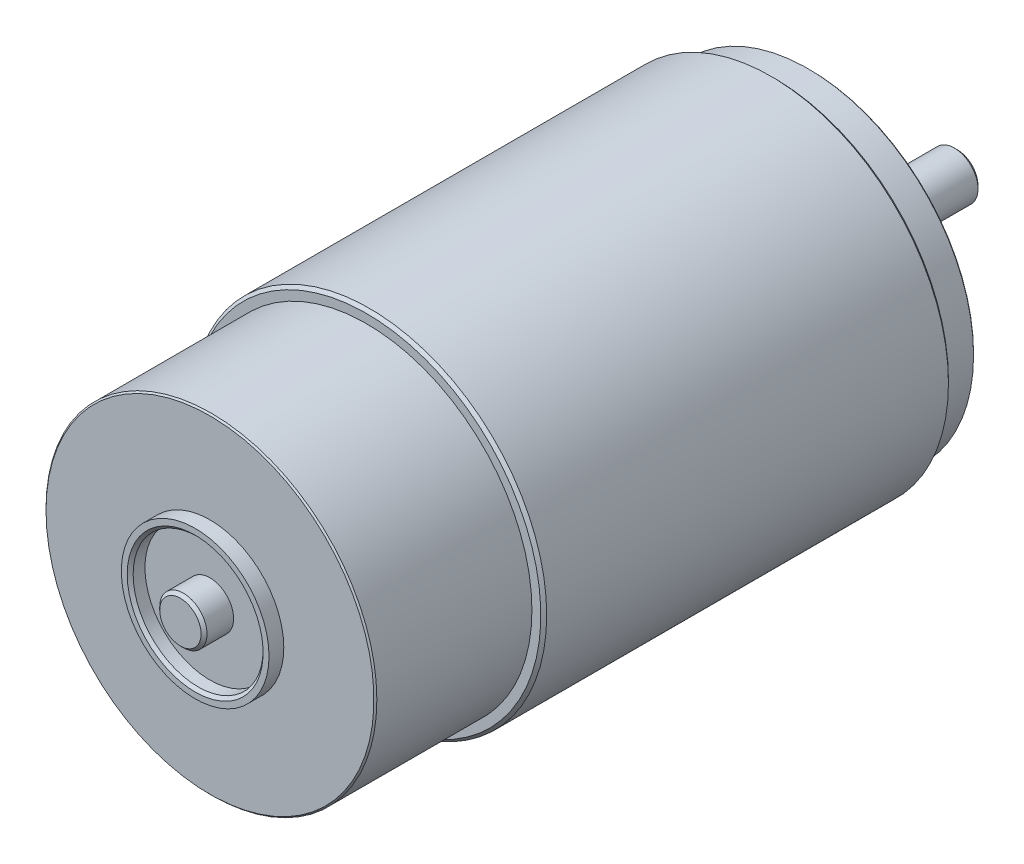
SolidWorks part; units mm, degrees
ref_plane "Front Plane" through (0, 0, 0) normal (0, 0, 1) x (1, 0, 0)
ref_plane "Top Plane" through (0, 0, 0) normal (0, 1, 0) x (1, 0, 0)
ref_plane "Right Plane" through (0, 0, 0) normal (1, 0, 0) x (0, 0, -1)
sketch "Sketch1" plane through (0, 0, 0) normal (0, 1, 0) x (1, 0, 0)
  line L0 (-8.5379, -81.0483) -> (-8.5379, 50.4517) construction
  line L1 (-8.5379, -81.0483) -> (-12.5379, -81.0483)
  line L2 (-12.5379, -81.0483) -> (-12.5379, -76.0483)
  line L3 (-12.5379, -76.0483) -> (-19.5379, -76.0483)
  line L4 (-19.5379, -76.0483) -> (-19.5379, -78.5483)
  line L5 (-19.5379, -78.5483) -> (-21.0379, -78.5483)
  line L6 (-21.0379, -78.5483) -> (-21.0379, -76.0483)
  line L7 (-21.0379, -76.0483) -> (-36.5379, -76.0483)
  line L8 (-36.5379, -76.0483) -> (-36.5379, -49.5483)
  line L9 (-36.5379, -49.5483) -> (-38.5379, -49.5483)
  line L10 (-38.5379, -49.5483) -> (-38.5379, 19.4517)
  line L11 (-38.5379, 19.4517) -> (-36.5379, 19.4517)
  line L12 (-36.5379, 19.4517) -> (-36.5379, 25.4517)
  line L13 (-36.5379, 25.4517) -> (-21.0379, 25.4517)
  line L14 (-21.0379, 25.4517) -> (-21.0379, 27.9517)
  line L15 (-21.0379, 27.9517) -> (-19.5379, 27.9517)
  line L16 (-19.5379, 27.9517) -> (-19.5379, 25.4517)
  line L17 (-19.5379, 25.4517) -> (-12.5379, 25.4517)
  line L18 (-12.5379, 25.4517) -> (-12.5379, 50.4517)
  line L19 (-12.5379, 50.4517) -> (-8.5379, 50.4517)
  line L20 (-8.5379, -81.0483) -> (-8.5379, 50.4517)
  dimension "D1" = 8
  dimension "D2" = 22
  dimension "D3" = 25
  dimension "D4" = 56
  dimension "D5" = 60
  dimension "D6" = 56
  dimension "D7" = 25
  dimension "D8" = 22
  dimension "D9" = 8
  dimension "D10" = 2.5
  dimension "D11" = 5
  dimension "D12" = 26.5
  dimension "D13" = 69
  dimension "D14" = 6
  dimension "D15" = 2.5
  dimension "D16" = 25
revolve "Revolve1" add sketch "Sketch1" angle 360 about L0
chamfer "Chamfer1" distance 0.5 angle 45 2 edges at (21.4621, 0, -19.4517) (21.4621, 0, 49.5483)
chamfer "Chamfer2" distance 0.5 angle 45 2 edges at (2.4621, 0, 78.5483) (2.4621, 0, -27.9517)
chamfer "Chamfer3" distance 0.5 angle 45 2 edges at (-4.5379, 0, -50.4517) (-4.5379, 0, 81.0483)
chamfer "Chamfer4" distance 0.25 angle 45 2 edges at (19.4621, 0, 76.0483) (19.4621, 0, -25.4517)
